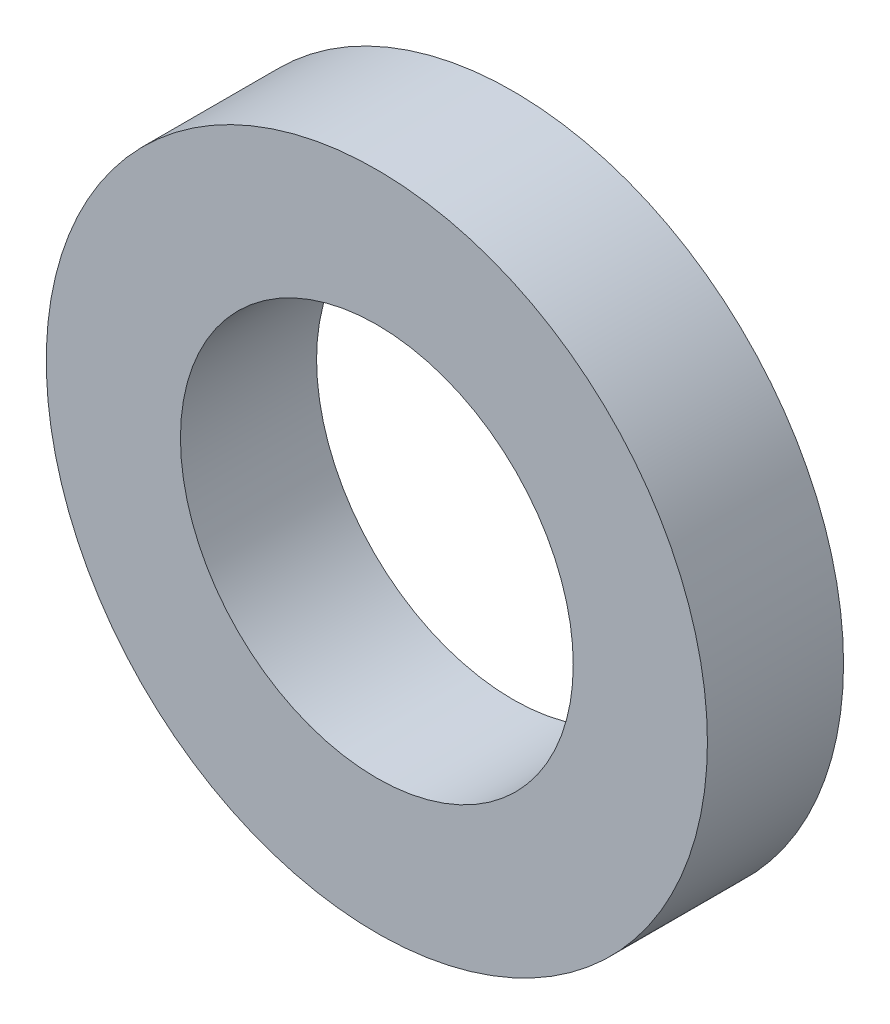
SolidWorks part; units mm, degrees
ref_plane "前视基准面" through (0, 0, 0) normal (0, 0, 1) x (1, 0, 0)
ref_plane "上视基准面" through (0, 0, 0) normal (0, 1, 0) x (1, 0, 0)
ref_plane "右视基准面" through (0, 0, 0) normal (1, 0, 0) x (0, 0, -1)
other "Configuration Table"
sketch "草图1" plane through (0, 0, 0) normal (0, 0, 1) x (1, 0, 0)
  circle A0 centre (0, 0) radius 17
  circle A1 centre (0, 0) radius 10.1
  dimension "D1" = 20.2
  dimension "D2" = 34
extrude "Wrist_Bearing_20x34x7_Envelope" add sketch "草图1" against normal mid plane 7
